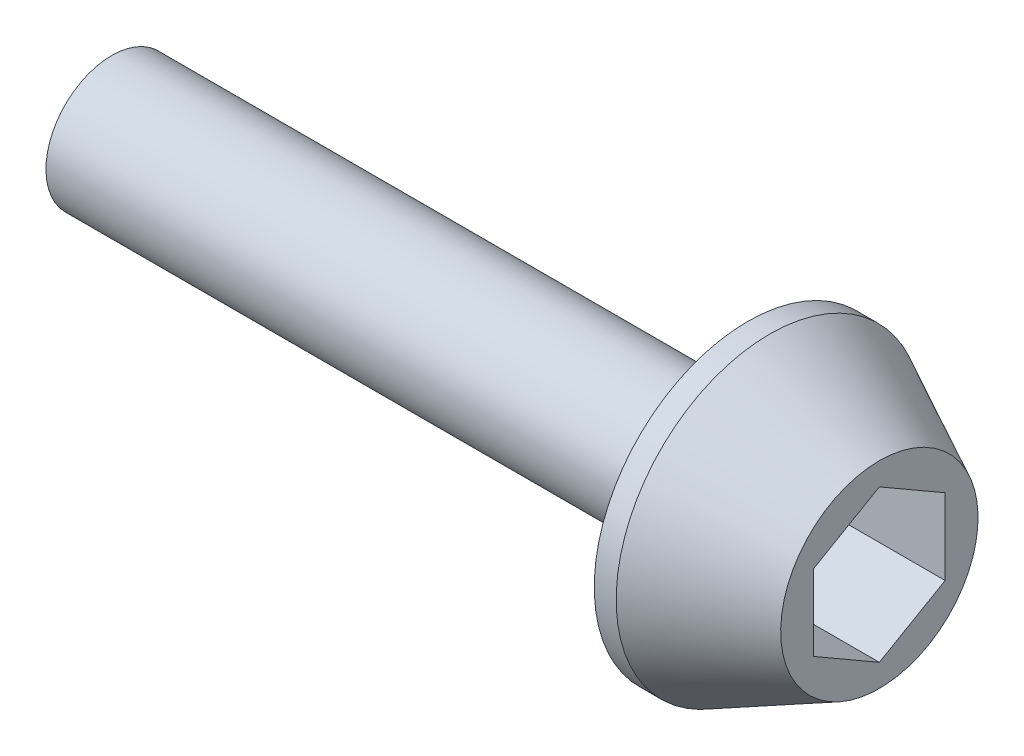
SolidWorks part; units mm, degrees
ref_plane "Alzado" through (0, 0, 0) normal (0, 0, 1) x (1, 0, 0)
ref_plane "Planta" through (0, 0, 0) normal (0, 1, 0) x (1, 0, 0)
ref_plane "Vista lateral" through (0, 0, 0) normal (1, 0, 0) x (0, 0, -1)
sketch "Croquis1" plane through (0, 0, 0) normal (0, 0, 1) x (1, 0, 0)
  line L0 (0, 0) -> (-35, 0) construction
  line L2 (0, 4.5) -> (0, 0)
  line L4 (-35, 3) -> (-35, 2)
  line L5 (-35, 0) -> (-35, 2) construction
  line L7 (-35, 3) -> (-6, 3)
  line L8 (-6, 3) -> (-6, 7)
  line L9 (-6, 7) -> (-5, 7)
  line L10 (-5, 7) -> (0, 4.5)
  line L11 (-35, 2) -> (-6, 2)
  line L12 (-6, 2) -> (-6, 0)
  line L13 (-6, 0) -> (0, 0)
  dimension "D1" = 35
  dimension "D2" = 1
  dimension "D3" = 3
  dimension "D4" = 7
  dimension "D5" = 6
  dimension "D6" = 1
  dimension "D7" = 4.5
revolve "Revolución1" add sketch "Croquis1" angle 360 about L0
sketch "Croquis2" plane through (0, 0, 0) normal (1, 0, 0) x (0, 0, -1)
  line L1 (0, 3.4641) -> (-3, 1.7321)
  line L2 (-3, 1.7321) -> (-3, -1.7321)
  line L3 (-3, -1.7321) -> (0, -3.4641)
  line L4 (0, -3.4641) -> (3, -1.7321)
  line L5 (3, -1.7321) -> (3, 1.7321)
  line L6 (3, 1.7321) -> (0, 3.4641)
  circle A0 centre (0, 0) radius 3 construction
  dimension "D1" = 6
extrude "Cortar-Extruir1" cut sketch "Croquis2" against normal blind 5
